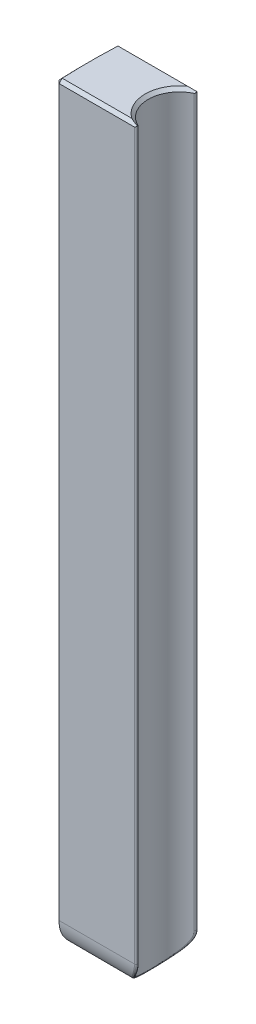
SolidWorks part; units mm, degrees
ref_plane "Спереди" through (0, 0, 0) normal (0, 0, 1) x (1, 0, 0)
ref_plane "Сверху" through (0, 0, 0) normal (0, 1, 0) x (1, 0, 0)
ref_plane "Справа" through (0, 0, 0) normal (1, 0, 0) x (0, 0, -1)
sketch "Эскиз2" plane through (0, 0, 0) normal (1, 0, 0) x (0, 0, -1)
  line L0 (-1, 0) -> (-1, 23.5)
  line L1 (-1, 23.5) -> (1, 23.5)
  line L2 (1, 23.5) -> (1, 0)
  arc A0 (-1, 0) -> (1, 0) centre (0, 0) ccw
  dimension "D1" = 2
  dimension "D2" = 23.5
extrude "Бобышка-Вытянуть1" add sketch "Эскиз2" along normal blind 3
sketch "Эскиз3" plane through (0, 0, 0) normal (0, 1, 0) x (1, 0, 0)
  line L0 (3, 1) -> (3, -1) construction
  line L2 (3, 1) -> (0, 1) construction
  line L3 (3, -1) -> (0, -1) construction
  line L4 (3, 1) -> (0.025, 1)
  line L5 (3, -1) -> (0.025, -1)
  arc A0 (3, 1) -> (3, -1) centre (3, 0) ccw
  arc A1 (0.025, 1) -> (0.025, -1) centre (20, 0) ccw
  dimension "D1" = 40
extrude "Вырез-Вытянуть1" cut sketch "Эскиз3" against normal mid plane 53 flip side to cut
chamfer "Фаска1" distance 0.1 angle 45 7 edges at (1.5125, 23.5, -1) (2, 23.5, 0) (1.5125, 23.5, 1) (0, 23.5, 0) (0.025, 11.75, -1) (0.025, 11.75, 1) (0.0003, -0.9933, 0.1152)
fillet "Скругление1" radius 0.05 3 edges at (3, 11.7, -1) (2, -1, 0) (3, 11.7, 1)
